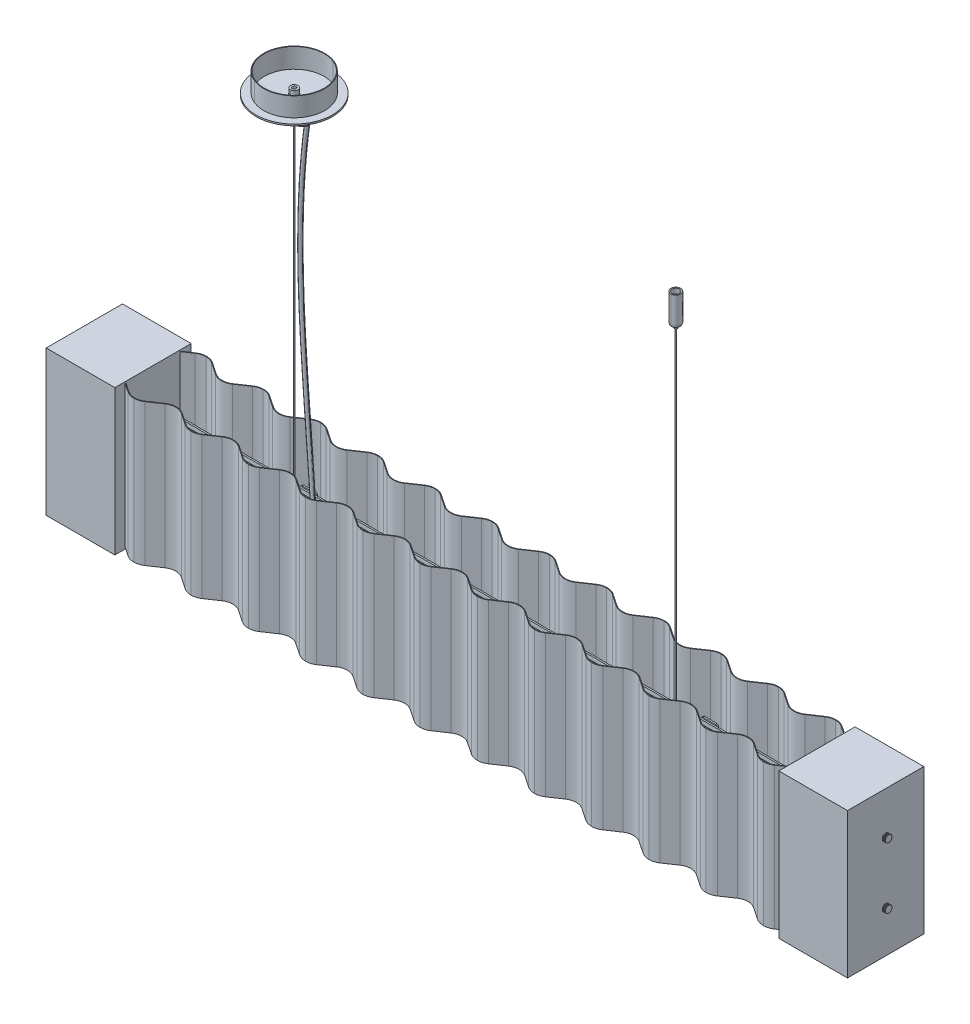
SolidWorks part; units mm, degrees
ref_plane "Alzado" through (0, 0, 0) normal (0, 0, 1) x (1, 0, 0)
ref_plane "Planta" through (0, 0, 0) normal (0, 1, 0) x (1, 0, 0)
ref_plane "Vista lateral" through (0, 0, 0) normal (1, 0, 0) x (0, 0, -1)
imported_body "NOSA 3D DRAWNG.STEP-1/________.STEP-1/______.STEP-1-solid1"
imported_body "NOSA 3D DRAWNG.STEP-1/________.STEP-1/__________.STEP-1-solid1"
imported_body "NOSA 3D DRAWNG.STEP-1/________.STEP-1/__________.STEP-2-solid1"
imported_body "NOSA 3D DRAWNG.STEP-1/________.STEP-1/32____5________.STEP-1-solid1"
imported_body "NOSA 3D DRAWNG.STEP-1/________.STEP-1/32____5________.STEP-2-solid1"
imported_body "NOSA 3D DRAWNG.STEP-1/________.STEP-1/32____5________.STEP-3-solid1"
imported_body "NOSA 3D DRAWNG.STEP-1/________.STEP-1/32____5________.STEP-4-solid1"
imported_body "NOSA 3D DRAWNG.STEP-1/________.STEP-1/__________________.STEP-1-solid1"
imported_body "NOSA 3D DRAWNG.STEP-1/________.STEP-1/__________________.STEP-2-solid1"
imported_body "NOSA 3D DRAWNG.STEP-1/________.STEP-1/__________________.STEP-3-solid1"
imported_body "NOSA 3D DRAWNG.STEP-1/________.STEP-1/__________________.STEP-4-solid1"
imported_body "NOSA 3D DRAWNG.STEP-1/________.STEP-1/__________________.STEP-5-solid1"
imported_body "NOSA 3D DRAWNG.STEP-1/________.STEP-1/__________________.STEP-6-solid1"
imported_body "NOSA 3D DRAWNG.STEP-1/________.STEP-1/______________.STEP-1-solid1"
imported_body "NOSA 3D DRAWNG.STEP-1/________.STEP-1/__________-0.STEP-1-solid1"
imported_body "NOSA 3D DRAWNG.STEP-1/________.STEP-1/__________-0.STEP-2-solid1"
imported_body "NOSA 3D DRAWNG.STEP-1/________.STEP-1/______-1.STEP-1-solid1"
imported_body "NOSA 3D DRAWNG.STEP-1/________.STEP-1/______-1.STEP-2-solid1"
imported_body "NOSA 3D DRAWNG.STEP-1/________.STEP-1/______-1.STEP-3-solid1"
imported_body "NOSA 3D DRAWNG.STEP-1/________.STEP-1/______-1.STEP-4-solid1"
imported_body "NOSA 3D DRAWNG.STEP-1/____________.STEP-1/__________ -________.STEP-1-solid1"
imported_body "NOSA 3D DRAWNG.STEP-1/____________.STEP-1/__________ -________.STEP-1-solid2"
imported_body "NOSA 3D DRAWNG.STEP-1/____________.STEP-1/__________-2.STEP-1-solid1"
imported_body "NOSA 3D DRAWNG.STEP-1/____________.STEP-1/__________-2.STEP-2-solid1"
imported_body "NOSA 3D DRAWNG.STEP-1/____________.STEP-2/__________ -________.STEP-1-solid1"
imported_body "NOSA 3D DRAWNG.STEP-1/____________.STEP-2/__________ -________.STEP-1-solid2"
imported_body "NOSA 3D DRAWNG.STEP-1/____________.STEP-2/__________-2.STEP-1-solid1"
imported_body "NOSA 3D DRAWNG.STEP-1/____________.STEP-2/__________-2.STEP-2-solid1"
imported_body "NOSA 3D DRAWNG.STEP-1/______-3.STEP-1-solid1"
imported_body "NOSA 3D DRAWNG.STEP-1/______________-4.STEP-1-solid1"
imported_body "NOSA 3D DRAWNG.STEP-1/____.STEP-1-solid1"
imported_body "NOSA 3D DRAWNG.STEP-1/__________2.STEP-1-solid1"
imported_body "NOSA 3D DRAWNG.STEP-1/____.STEP-2-solid1"
imported_body "NOSA 3D DRAWNG.STEP-1/__________-5.STEP-1-solid1"
imported_body "NOSA 3D DRAWNG.STEP-1/__________-5.STEP-2-solid1"
imported_body "NOSA 3D DRAWNG.STEP-1/32__5________.STEP-1-solid1"
imported_body "NOSA 3D DRAWNG.STEP-1/32__5________.STEP-2-solid1"
imported_body "NOSA 3D DRAWNG.STEP-1/32__5________.STEP-3-solid1"
imported_body "NOSA 3D DRAWNG.STEP-1/32__5________.STEP-4-solid1"
imported_body "NOSA 3D DRAWNG.STEP-1/__________-6.STEP-1-solid1"
imported_body "NOSA 3D DRAWNG.STEP-1/______-7.STEP-1-solid1"
imported_body "NOSA 3D DRAWNG.STEP-1/gu10____+____.STEP-1-solid1"
imported_body "NOSA 3D DRAWNG.STEP-1/______ ____.STEP-1-solid1"
imported_body "NOSA 3D DRAWNG.STEP-1/gu10____+____.STEP-2-solid1"
imported_body "NOSA 3D DRAWNG.STEP-1/gu10____+____.STEP-3-solid1"
imported_body "NOSA 3D DRAWNG.STEP-1/gu10____+____.STEP-4-solid1"
imported_body "NOSA 3D DRAWNG.STEP-1/______ ____.STEP-2-solid1"
imported_body "NOSA 3D DRAWNG.STEP-1/______ ____.STEP-3-solid1"
imported_body "NOSA 3D DRAWNG.STEP-1/______ ____.STEP-4-solid1"
imported_body "NOSA 3D DRAWNG.STEP-1/______-7.STEP-2-solid1"
imported_body "NOSA 3D DRAWNG.STEP-1/______-7.STEP-3-solid1"
imported_body "NOSA 3D DRAWNG.STEP-1/______-7.STEP-4-solid1"
imported_body "NOSA 3D DRAWNG.STEP-1/__________-6.STEP-2-solid1"
imported_body "NOSA 3D DRAWNG.STEP-1/__________-6.STEP-3-solid1"
imported_body "NOSA 3D DRAWNG.STEP-1/__________-6.STEP-4-solid1"
imported_body "NOSA 3D DRAWNG.STEP-1/________________.STEP-1-solid1"
imported_body "NOSA 3D DRAWNG.STEP-1/____8^________.STEP-1-solid1"
sketch "Croquis3" plane through (-485, 0, 0) normal (1, 0, 0) x (0, 0, -1)
  line L4 (50, -105) -> (50, 85)
  line L5 (50, 85) -> (-50, 85)
  line L6 (-50, 85) -> (-50, -105)
  line L7 (-50, -105) -> (50, -105)
  line L8 (50, -105) -> (50, 85)
  line L9 (50, 85) -> (-50, 85)
  line L10 (-50, 85) -> (-50, -105)
  line L11 (-50, -105) -> (50, -105)
  dimension "D1" = 0
extrude "Saliente-Extruir4" add sketch "Croquis3" along normal blind 50
sketch "Croquis4" plane through (485, 0, 0) normal (-1, 0, 0) x (0, 0, 1)
  line L4 (50, -105) -> (50, 85)
  line L5 (50, 85) -> (-50, 85)
  line L6 (-50, 85) -> (-50, -105)
  line L7 (-50, -105) -> (50, -105)
  line L8 (50, -105) -> (50, 85)
  line L9 (50, 85) -> (-50, 85)
  line L10 (-50, 85) -> (-50, -105)
  line L11 (-50, -105) -> (50, -105)
  dimension "D1" = 0
extrude "Saliente-Extruir5" add sketch "Croquis4" along normal blind 50
